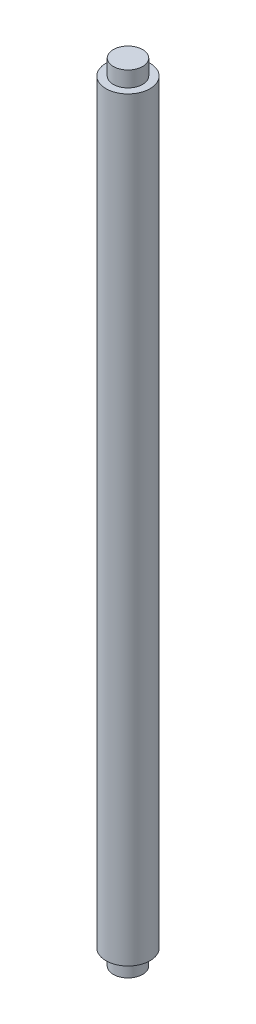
SolidWorks part; units mm, degrees
ref_plane "Front Plane" through (0, 0, 0) normal (0, 0, 1) x (1, 0, 0)
ref_plane "Top Plane" through (0, 0, 0) normal (0, 1, 0) x (1, 0, 0)
ref_plane "Right Plane" through (0, 0, 0) normal (1, 0, 0) x (0, 0, -1)
sketch "Sketch1" plane through (0, 0, 0) normal (0, 1, 0) x (1, 0, 0)
  circle A0 centre (0, 0) radius 2.25
  dimension "D1" = 4.5
extrude "Boss-Extrude1" add sketch "Sketch1" along normal blind 77.1
sketch "Sketch2" plane through (0, 0, 0) normal (0, -1, 0) x (1, 0, 0)
  circle A0 centre (0, 0) radius 1.5
  dimension "D1" = 3
extrude "Boss-Extrude2" add sketch "Sketch2" along normal blind 1.5875
sketch "Sketch3" plane through (0, 77.1, 0) normal (0, 1, 0) x (1, 0, 0)
  circle A0 centre (0, 0) radius 1.5
  dimension "D1" = 3
extrude "Boss-Extrude3" add sketch "Sketch3" along normal blind 1.5875
